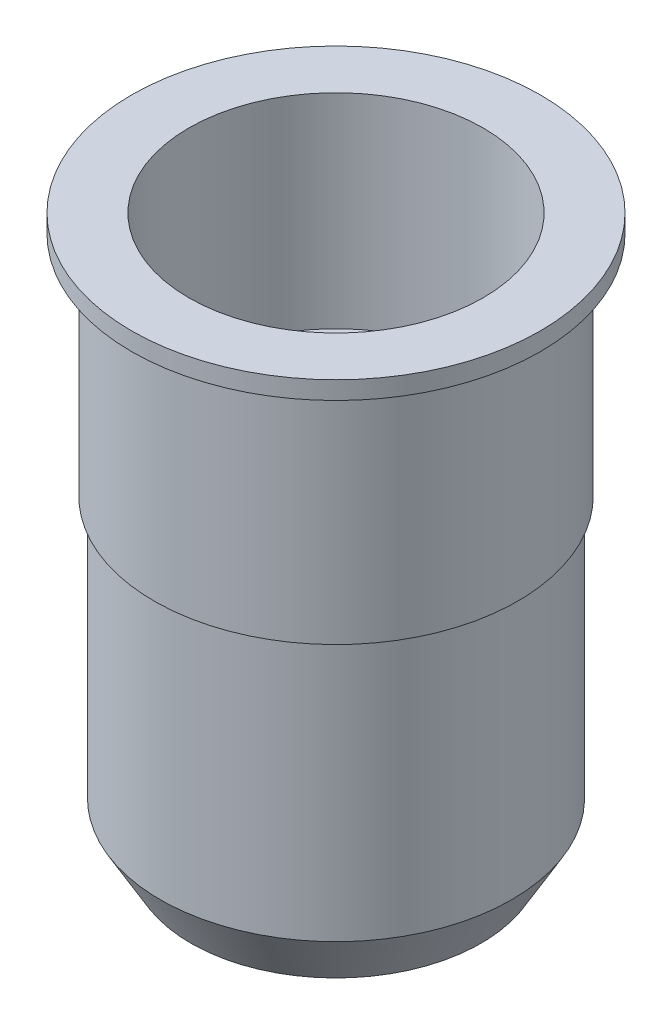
SolidWorks part; units mm, degrees
ref_plane "Plan1" through (0, 0, 0) normal (0, 0, 1) x (1, 0, 0)
ref_plane "Plan2" through (0, 0, 0) normal (0, 1, 0) x (1, 0, 0)
ref_plane "Plan3" through (0, 0, 0) normal (1, 0, 0) x (0, 0, -1)
sketch "Esquisse1" plane through (0, 0, 0) normal (0, 0, 1) x (1, 0, 0)
  line L0 (0, 6.3015) -> (0, -6.3015) construction
  line L1 (2.5, -13.7) -> (2.5, -5)
  line L2 (2.5, -5) -> (3.6, -5)
  line L3 (3.6, -5) -> (3.6, 0)
  line L4 (3.6, 0) -> (5, 0)
  line L5 (5, 0) -> (5, -0.7)
  line L6 (4.3, -13.7) -> (4.3, -6)
  line L7 (4.3, -13.7) -> (2.5, -13.7)
  line L8 (4.45, -0.7) -> (5, -0.7)
  line L9 (4.3, -6) -> (4.45, -6)
  line L10 (4.45, -6) -> (4.45, -0.7)
  dimension "D1" = 5
  dimension "D2" = 7.2
  dimension "D3" = 5
  dimension "D4" = 0.7
  dimension "D5" = 8.9
  dimension "D6" = 8.6
  dimension "D7" = 6
  dimension "D8" = 10
  dimension "D9" = 13.7
revolve "Base-Révolution" add sketch "Esquisse1" angle 360 about L0
chamfer "Chanfrein3" distance 0.75 angle 60
chamfer "Chanfrein5" distance 0.45 angle 30
